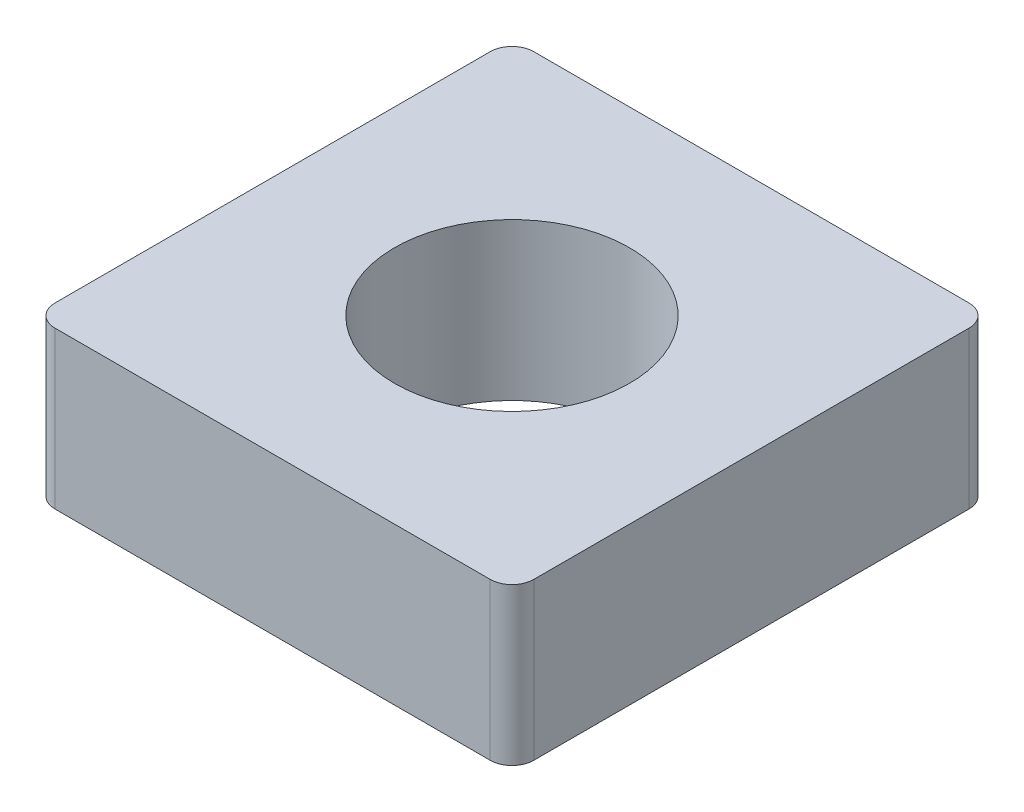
SolidWorks part; units mm, degrees
ref_plane "Front" through (0, 0, 0) normal (0, 0, 1) x (1, 0, 0)
ref_plane "Top" through (0, 0, 0) normal (0, 1, 0) x (1, 0, 0)
ref_plane "Right" through (0, 0, 0) normal (1, 0, 0) x (0, 0, -1)
sketch "Sketch1" plane through (0, 0, 0) normal (0, 1, 0) x (1, 0, 0)
  line L1 (2.75, -2.75) -> (-2.75, -2.75)
  line L2 (2.75, -2.75) -> (2.75, 2.75)
  line L3 (2.75, 2.75) -> (-2.75, 2.75)
  line L4 (-2.75, -2.75) -> (-2.75, 2.75)
  line L5 (2.75, -2.75) -> (-2.75, 2.75) construction
  line L6 (2.75, 2.75) -> (-2.75, -2.75) construction
  circle A0 centre (0, 0) radius 1.35
  point P0 (0, 0)
  dimension "D1" = 2.7
  dimension "D2" = 5.5
extrude "Boss-Extrude1" add sketch "Sketch1" along normal blind 1.8
fillet "Fillet1" radius 0.25 4 edges at (-2.75, 0.9, -2.75) (2.75, 0.9, -2.75) (-2.75, 0.9, 2.75) (2.75, 0.9, 2.75)
